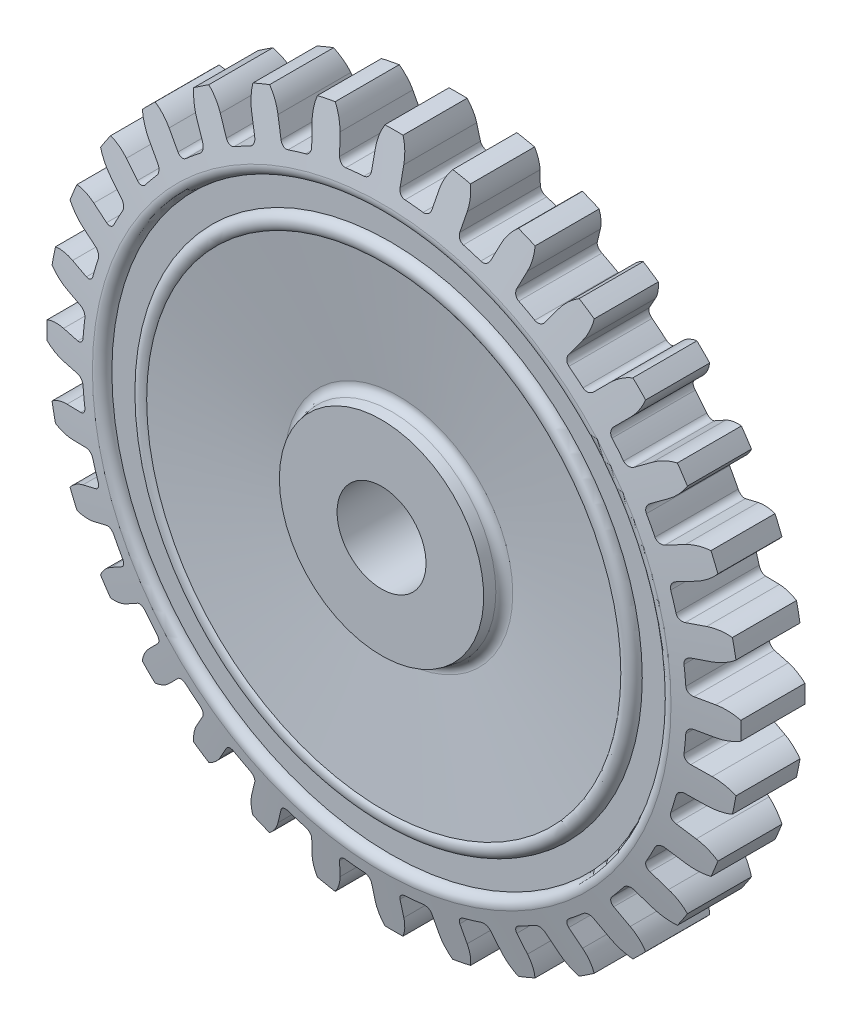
SolidWorks part; units mm, degrees
ref_plane "Спереди" through (0, 0, 0) normal (0, 0, 1) x (1, 0, 0)
ref_plane "Сверху" through (0, 0, 0) normal (0, 1, 0) x (1, 0, 0)
ref_plane "Справа" through (0, 0, 0) normal (1, 0, 0) x (0, 0, -1)
sketch "Эскиз1" plane through (0, 0, 0) normal (0, 1, 0) x (1, 0, 0)
  line L0 (-39, 0) -> (0, 0) construction
  line L1 (-39, -3.6) -> (-39, 3.6)
  line L2 (-5, 5) -> (-5, -5)
  line L3 (-5, 5) -> (-11.485, 5)
  line L4 (-39, 3.6) -> (-32.5163, 4.9781)
  line L5 (-31.3084, 4) -> (-28.3084, 4)
  line L6 (-11.485, 5) -> (-11.7107, 3.8603)
  line L7 (-12.8127, 3.0619) -> (-26.647, 4.75)
  line L8 (-5, -5) -> (-11.485, -5)
  line L9 (-11.485, -5) -> (-11.7107, -3.8603)
  line L10 (-12.8127, -3.0619) -> (-26.647, -4.75)
  line L11 (-31.3084, -4) -> (-28.3084, -4)
  line L12 (-39, -3.6) -> (-32.5163, -4.9781)
  line L13 (0, 5) -> (0, -5) construction
  arc A0 (-31.3084, 4) -> (-32.5163, 4.9781) centre (-32.3084, 4) ccw
  arc A1 (-26.647, 4.75) -> (-28.3084, 4) centre (-27.3084, 4) ccw
  arc A2 (-11.7107, 3.8603) -> (-12.8127, 3.0619) centre (-12.6916, 4.0546) cw
  arc A3 (-11.7107, -3.8603) -> (-12.8127, -3.0619) centre (-12.6916, -4.0546) ccw
  arc A4 (-26.647, -4.75) -> (-28.3084, -4) centre (-27.3084, -4) cw
  arc A5 (-31.3084, -4) -> (-32.5163, -4.9781) centre (-32.3084, -4) cw
  point P17 (-5, 0)
  dimension "D7" = 2
  dimension "D13" = 1
  dimension "D1" = 39
  dimension "D2" = 5
  dimension "D3" = 5
  dimension "D4" = 6.485
  dimension "D5" = 3.6
  dimension "D6" = 12
  dimension "D8" = 3
  dimension "D9" = 4
  dimension "D10" = 11.2
  dimension "D11" = 6.957
  dimension "D12" = 0.25
revolve "Повернуть1" add sketch "Эскиз1" angle 360 about L13
sketch "Эскиз6" plane through (0, 0, 0) normal (0, 0, 1) x (1, 0, 0)
  line L0 (0, 50.9999) -> (0, 0) construction
  line L1 (1.6, 36.6426) -> (1.6, 34.6301)
  line L2 (0, 0) -> (3.607, 36.6228) construction
  line L3 (-1.6, 36.6426) -> (-1.6, 34.6301)
  line L4 (8.7179, 35.6264) -> (8.3253, 33.6525)
  line L5 (5.5794, 36.2507) -> (5.1867, 34.2768)
  line L6 (15.5007, 33.2411) -> (14.7306, 31.3817)
  line L7 (12.5443, 34.4656) -> (11.7742, 32.6063)
  line L8 (21.6879, 29.5783) -> (20.5698, 27.905)
  line L9 (19.0272, 31.3561) -> (17.9091, 29.6828)
  line L10 (27.0416, 24.7789) -> (25.6185, 23.3558)
  line L11 (24.7789, 27.0416) -> (23.3558, 25.6185)
  line L12 (31.3561, 19.0272) -> (29.6828, 17.9091)
  line L13 (29.5783, 21.6879) -> (27.905, 20.5698)
  line L14 (34.4656, 12.5443) -> (32.6063, 11.7742)
  line L15 (33.2411, 15.5007) -> (31.3817, 14.7306)
  line L16 (36.2507, 5.5794) -> (34.2768, 5.1867)
  line L17 (35.6264, 8.7179) -> (33.6525, 8.3253)
  line L18 (36.6426, -1.6) -> (34.6301, -1.6)
  line L19 (36.6426, 1.6) -> (34.6301, 1.6)
  line L20 (35.6264, -8.7179) -> (33.6525, -8.3253)
  line L21 (36.2507, -5.5794) -> (34.2768, -5.1867)
  line L22 (33.2411, -15.5007) -> (31.3817, -14.7306)
  line L23 (34.4656, -12.5443) -> (32.6063, -11.7742)
  line L24 (29.5783, -21.6879) -> (27.905, -20.5698)
  line L25 (31.3561, -19.0272) -> (29.6828, -17.9091)
  line L26 (24.7789, -27.0416) -> (23.3558, -25.6185)
  line L27 (27.0416, -24.7789) -> (25.6185, -23.3558)
  line L28 (19.0272, -31.3561) -> (17.9091, -29.6828)
  line L29 (21.6879, -29.5783) -> (20.5698, -27.905)
  line L30 (12.5443, -34.4656) -> (11.7742, -32.6063)
  line L31 (15.5007, -33.2411) -> (14.7306, -31.3817)
  line L32 (5.5794, -36.2507) -> (5.1867, -34.2768)
  line L33 (8.7179, -35.6264) -> (8.3253, -33.6525)
  line L34 (-1.6, -36.6426) -> (-1.6, -34.6301)
  line L35 (1.6, -36.6426) -> (1.6, -34.6301)
  line L36 (-8.7179, -35.6264) -> (-8.3253, -33.6525)
  line L37 (-5.5794, -36.2507) -> (-5.1867, -34.2768)
  line L38 (-15.5007, -33.2411) -> (-14.7306, -31.3817)
  line L39 (-12.5443, -34.4656) -> (-11.7742, -32.6063)
  line L40 (-21.6879, -29.5783) -> (-20.5698, -27.905)
  line L41 (-19.0272, -31.3561) -> (-17.9091, -29.6828)
  line L42 (-27.0416, -24.7789) -> (-25.6185, -23.3558)
  line L43 (-24.7789, -27.0416) -> (-23.3558, -25.6185)
  line L44 (-31.3561, -19.0272) -> (-29.6828, -17.9091)
  line L45 (-29.5783, -21.6879) -> (-27.905, -20.5698)
  line L46 (-34.4656, -12.5443) -> (-32.6063, -11.7742)
  line L47 (-33.2411, -15.5007) -> (-31.3817, -14.7306)
  line L48 (-36.2507, -5.5794) -> (-34.2768, -5.1867)
  line L49 (-35.6264, -8.7179) -> (-33.6525, -8.3253)
  line L50 (-36.6426, 1.6) -> (-34.6301, 1.6)
  line L51 (-36.6426, -1.6) -> (-34.6301, -1.6)
  line L52 (-35.6264, 8.7179) -> (-33.6525, 8.3253)
  line L53 (-36.2507, 5.5794) -> (-34.2768, 5.1867)
  line L54 (-33.2411, 15.5007) -> (-31.3817, 14.7306)
  line L55 (-34.4656, 12.5443) -> (-32.6063, 11.7742)
  line L56 (-29.5783, 21.6879) -> (-27.905, 20.5698)
  line L57 (-31.3561, 19.0272) -> (-29.6828, 17.9091)
  line L58 (-24.7789, 27.0416) -> (-23.3558, 25.6185)
  line L59 (-27.0416, 24.7789) -> (-25.6185, 23.3558)
  line L60 (-19.0272, 31.3561) -> (-17.9091, 29.6828)
  line L61 (-21.6879, 29.5783) -> (-20.5698, 27.905)
  line L62 (-12.5443, 34.4656) -> (-11.7742, 32.6063)
  line L63 (-15.5007, 33.2411) -> (-14.7306, 31.3817)
  line L64 (-5.5794, 36.2507) -> (-5.1867, 34.2768)
  line L65 (-8.7179, 35.6264) -> (-8.3253, 33.6525)
  arc A0 (-2.3087, 33.8714) -> (-4.3436, 33.671) centre (0, 0) ccw
  circle A1 centre (0, 0) radius 36.8 construction
  circle A2 centre (0, 0) radius 39 construction
  arc A3 (1.0164, 38.9868) -> (-1.0164, 38.9868) centre (0, 0) ccw
  arc A4 (-1.0164, 38.9868) -> (-1.6, 36.6426) centre (3.4, 36.6426) ccw
  arc A5 (1.0164, 38.9868) -> (1.6, 36.6426) centre (-3.4, 36.6426) cw
  arc A6 (8.6028, 38.0393) -> (6.609, 38.4359) centre (0, 0) ccw
  arc A7 (6.609, 38.4359) -> (5.5794, 36.2507) centre (10.4833, 35.2752) ccw
  arc A8 (8.6028, 38.0393) -> (8.7179, 35.6264) centre (3.8139, 36.6018) cw
  arc A9 (15.8587, 35.6301) -> (13.9805, 36.408) centre (0, 0) ccw
  arc A10 (13.9805, 36.408) -> (12.5443, 34.4656) centre (17.1637, 32.5522) ccw
  arc A11 (15.8587, 35.6301) -> (15.5007, 33.2411) centre (10.8813, 35.1545) cw
  arc A12 (22.505, 31.8516) -> (20.8147, 32.981) centre (0, 0) ccw
  arc A13 (20.8147, 32.981) -> (19.0272, 31.3561) centre (23.1845, 28.5783) ccw
  arc A14 (22.505, 31.8516) -> (21.6879, 29.5783) centre (17.5305, 32.3561) cw
  arc A15 (28.2865, 26.8491) -> (26.8491, 28.2865) centre (0, 0) ccw
  arc A16 (26.8491, 28.2865) -> (24.7789, 27.0416) centre (28.3144, 23.5061) ccw
  arc A17 (28.2865, 26.8491) -> (27.0416, 24.7789) centre (23.5061, 28.3144) cw
  arc A18 (32.981, 20.8147) -> (31.8516, 22.505) centre (0, 0) ccw
  arc A19 (31.8516, 22.505) -> (29.5783, 21.6879) centre (32.3561, 17.5305) ccw
  arc A20 (32.981, 20.8147) -> (31.3561, 19.0272) centre (28.5783, 23.1845) cw
  arc A21 (36.408, 13.9805) -> (35.6301, 15.8587) centre (0, 0) ccw
  arc A22 (35.6301, 15.8587) -> (33.2411, 15.5007) centre (35.1545, 10.8813) ccw
  arc A23 (36.408, 13.9805) -> (34.4656, 12.5443) centre (32.5522, 17.1637) cw
  arc A24 (38.4359, 6.609) -> (38.0393, 8.6028) centre (0, 0) ccw
  arc A25 (38.0393, 8.6028) -> (35.6264, 8.7179) centre (36.6018, 3.8139) ccw
  arc A26 (38.4359, 6.609) -> (36.2507, 5.5794) centre (35.2752, 10.4833) cw
  arc A27 (38.9868, -1.0164) -> (38.9868, 1.0164) centre (0, 0) ccw
  arc A28 (38.9868, 1.0164) -> (36.6426, 1.6) centre (36.6426, -3.4) ccw
  arc A29 (38.9868, -1.0164) -> (36.6426, -1.6) centre (36.6426, 3.4) cw
  arc A30 (38.0393, -8.6028) -> (38.4359, -6.609) centre (0, 0) ccw
  arc A31 (38.4359, -6.609) -> (36.2507, -5.5794) centre (35.2752, -10.4833) ccw
  arc A32 (38.0393, -8.6028) -> (35.6264, -8.7179) centre (36.6018, -3.8139) cw
  arc A33 (35.6301, -15.8587) -> (36.408, -13.9805) centre (0, 0) ccw
  arc A34 (36.408, -13.9805) -> (34.4656, -12.5443) centre (32.5522, -17.1637) ccw
  arc A35 (35.6301, -15.8587) -> (33.2411, -15.5007) centre (35.1545, -10.8813) cw
  arc A36 (31.8516, -22.505) -> (32.981, -20.8147) centre (0, 0) ccw
  arc A37 (32.981, -20.8147) -> (31.3561, -19.0272) centre (28.5783, -23.1845) ccw
  arc A38 (31.8516, -22.505) -> (29.5783, -21.6879) centre (32.3561, -17.5305) cw
  arc A39 (26.8491, -28.2865) -> (28.2865, -26.8491) centre (0, 0) ccw
  arc A40 (28.2865, -26.8491) -> (27.0416, -24.7789) centre (23.5061, -28.3144) ccw
  arc A41 (26.8491, -28.2865) -> (24.7789, -27.0416) centre (28.3144, -23.5061) cw
  arc A42 (20.8147, -32.981) -> (22.505, -31.8516) centre (0, 0) ccw
  arc A43 (22.505, -31.8516) -> (21.6879, -29.5783) centre (17.5305, -32.3561) ccw
  arc A44 (20.8147, -32.981) -> (19.0272, -31.3561) centre (23.1845, -28.5783) cw
  arc A45 (13.9805, -36.408) -> (15.8587, -35.6301) centre (0, 0) ccw
  arc A46 (15.8587, -35.6301) -> (15.5007, -33.2411) centre (10.8813, -35.1545) ccw
  arc A47 (13.9805, -36.408) -> (12.5443, -34.4656) centre (17.1637, -32.5522) cw
  arc A48 (6.609, -38.4359) -> (8.6028, -38.0393) centre (0, 0) ccw
  arc A49 (8.6028, -38.0393) -> (8.7179, -35.6264) centre (3.8139, -36.6018) ccw
  arc A50 (6.609, -38.4359) -> (5.5794, -36.2507) centre (10.4833, -35.2752) cw
  arc A51 (-1.0164, -38.9868) -> (1.0164, -38.9868) centre (0, 0) ccw
  arc A52 (1.0164, -38.9868) -> (1.6, -36.6426) centre (-3.4, -36.6426) ccw
  arc A53 (-1.0164, -38.9868) -> (-1.6, -36.6426) centre (3.4, -36.6426) cw
  arc A54 (-8.6028, -38.0393) -> (-6.609, -38.4359) centre (0, 0) ccw
  arc A55 (-6.609, -38.4359) -> (-5.5794, -36.2507) centre (-10.4833, -35.2752) ccw
  arc A56 (-8.6028, -38.0393) -> (-8.7179, -35.6264) centre (-3.8139, -36.6018) cw
  arc A57 (-15.8587, -35.6301) -> (-13.9805, -36.408) centre (0, 0) ccw
  arc A58 (-13.9805, -36.408) -> (-12.5443, -34.4656) centre (-17.1637, -32.5522) ccw
  arc A59 (-15.8587, -35.6301) -> (-15.5007, -33.2411) centre (-10.8813, -35.1545) cw
  arc A60 (-22.505, -31.8516) -> (-20.8147, -32.981) centre (0, 0) ccw
  arc A61 (-20.8147, -32.981) -> (-19.0272, -31.3561) centre (-23.1845, -28.5783) ccw
  arc A62 (-22.505, -31.8516) -> (-21.6879, -29.5783) centre (-17.5305, -32.3561) cw
  arc A63 (-28.2865, -26.8491) -> (-26.8491, -28.2865) centre (0, 0) ccw
  arc A64 (-26.8491, -28.2865) -> (-24.7789, -27.0416) centre (-28.3144, -23.5061) ccw
  arc A65 (-28.2865, -26.8491) -> (-27.0416, -24.7789) centre (-23.5061, -28.3144) cw
  arc A66 (-32.981, -20.8147) -> (-31.8516, -22.505) centre (0, 0) ccw
  arc A67 (-31.8516, -22.505) -> (-29.5783, -21.6879) centre (-32.3561, -17.5305) ccw
  arc A68 (-32.981, -20.8147) -> (-31.3561, -19.0272) centre (-28.5783, -23.1845) cw
  arc A69 (-36.408, -13.9805) -> (-35.6301, -15.8587) centre (0, 0) ccw
  arc A70 (-35.6301, -15.8587) -> (-33.2411, -15.5007) centre (-35.1545, -10.8813) ccw
  arc A71 (-36.408, -13.9805) -> (-34.4656, -12.5443) centre (-32.5522, -17.1637) cw
  arc A72 (-38.4359, -6.609) -> (-38.0393, -8.6028) centre (0, 0) ccw
  arc A73 (-38.0393, -8.6028) -> (-35.6264, -8.7179) centre (-36.6018, -3.8139) ccw
  arc A74 (-38.4359, -6.609) -> (-36.2507, -5.5794) centre (-35.2752, -10.4833) cw
  arc A75 (-38.9868, 1.0164) -> (-38.9868, -1.0164) centre (0, 0) ccw
  arc A76 (-38.9868, -1.0164) -> (-36.6426, -1.6) centre (-36.6426, 3.4) ccw
  arc A77 (-38.9868, 1.0164) -> (-36.6426, 1.6) centre (-36.6426, -3.4) cw
  arc A78 (-38.0393, 8.6028) -> (-38.4359, 6.609) centre (0, 0) ccw
  arc A79 (-38.4359, 6.609) -> (-36.2507, 5.5794) centre (-35.2752, 10.4833) ccw
  arc A80 (-38.0393, 8.6028) -> (-35.6264, 8.7179) centre (-36.6018, 3.8139) cw
  arc A81 (-35.6301, 15.8587) -> (-36.408, 13.9805) centre (0, 0) ccw
  arc A82 (-36.408, 13.9805) -> (-34.4656, 12.5443) centre (-32.5522, 17.1637) ccw
  arc A83 (-35.6301, 15.8587) -> (-33.2411, 15.5007) centre (-35.1545, 10.8813) cw
  arc A84 (-31.8516, 22.505) -> (-32.981, 20.8147) centre (0, 0) ccw
  arc A85 (-32.981, 20.8147) -> (-31.3561, 19.0272) centre (-28.5783, 23.1845) ccw
  arc A86 (-31.8516, 22.505) -> (-29.5783, 21.6879) centre (-32.3561, 17.5305) cw
  arc A87 (-26.8491, 28.2865) -> (-28.2865, 26.8491) centre (0, 0) ccw
  arc A88 (-28.2865, 26.8491) -> (-27.0416, 24.7789) centre (-23.5061, 28.3144) ccw
  arc A89 (-26.8491, 28.2865) -> (-24.7789, 27.0416) centre (-28.3144, 23.5061) cw
  arc A90 (-20.8147, 32.981) -> (-22.505, 31.8516) centre (0, 0) ccw
  arc A91 (-22.505, 31.8516) -> (-21.6879, 29.5783) centre (-17.5305, 32.3561) ccw
  arc A92 (-20.8147, 32.981) -> (-19.0272, 31.3561) centre (-23.1845, 28.5783) cw
  arc A93 (-13.9805, 36.408) -> (-15.8587, 35.6301) centre (0, 0) ccw
  arc A94 (-15.8587, 35.6301) -> (-15.5007, 33.2411) centre (-10.8813, 35.1545) ccw
  arc A95 (-13.9805, 36.408) -> (-12.5443, 34.4656) centre (-17.1637, 32.5522) cw
  arc A96 (-6.609, 38.4359) -> (-8.6028, 38.0393) centre (0, 0) ccw
  arc A97 (-8.6028, 38.0393) -> (-8.7179, 35.6264) centre (-3.8139, 36.6018) ccw
  arc A98 (-6.609, 38.4359) -> (-5.5794, 36.2507) centre (-10.4833, 35.2752) cw
  arc A99 (4.3436, 33.671) -> (2.3087, 33.8714) centre (0, 0) ccw
  arc A100 (10.829, 32.1766) -> (8.8723, 32.7702) centre (0, 0) ccw
  arc A101 (-8.8723, 32.7702) -> (-10.829, 32.1766) centre (0, 0) ccw
  arc A102 (-15.095, 30.4096) -> (-16.8983, 29.4457) centre (0, 0) ccw
  arc A103 (-20.7376, 26.8804) -> (-22.3182, 25.5832) centre (0, 0) ccw
  arc A104 (-25.5832, 22.3182) -> (-26.8804, 20.7376) centre (0, 0) ccw
  arc A105 (-29.4457, 16.8983) -> (-30.4096, 15.095) centre (0, 0) ccw
  arc A106 (-32.1766, 10.829) -> (-32.7702, 8.8723) centre (0, 0) ccw
  arc A107 (-33.671, 4.3436) -> (-33.8714, 2.3087) centre (0, 0) ccw
  arc A108 (-33.8714, -2.3087) -> (-33.671, -4.3436) centre (0, 0) ccw
  arc A109 (-32.7702, -8.8723) -> (-32.1766, -10.829) centre (0, 0) ccw
  arc A110 (-30.4096, -15.095) -> (-29.4457, -16.8983) centre (0, 0) ccw
  arc A111 (-26.8804, -20.7376) -> (-25.5832, -22.3182) centre (0, 0) ccw
  arc A112 (-22.3182, -25.5832) -> (-20.7376, -26.8804) centre (0, 0) ccw
  arc A113 (-16.8983, -29.4457) -> (-15.095, -30.4096) centre (0, 0) ccw
  arc A114 (-10.829, -32.1766) -> (-8.8723, -32.7702) centre (0, 0) ccw
  arc A115 (-4.3436, -33.671) -> (-2.3087, -33.8714) centre (0, 0) ccw
  arc A116 (2.3087, -33.8714) -> (4.3436, -33.671) centre (0, 0) ccw
  arc A117 (8.8723, -32.7702) -> (10.829, -32.1766) centre (0, 0) ccw
  arc A118 (15.095, -30.4096) -> (16.8983, -29.4457) centre (0, 0) ccw
  arc A119 (20.7376, -26.8804) -> (22.3182, -25.5832) centre (0, 0) ccw
  arc A120 (25.5832, -22.3182) -> (26.8804, -20.7376) centre (0, 0) ccw
  arc A121 (29.4457, -16.8983) -> (30.4096, -15.095) centre (0, 0) ccw
  arc A122 (32.1766, -10.829) -> (32.7702, -8.8723) centre (0, 0) ccw
  arc A123 (33.671, -4.3436) -> (33.8714, -2.3087) centre (0, 0) ccw
  arc A124 (33.8714, 2.3087) -> (33.671, 4.3436) centre (0, 0) ccw
  arc A125 (32.7702, 8.8723) -> (32.1766, 10.829) centre (0, 0) ccw
  arc A126 (30.4096, 15.095) -> (29.4457, 16.8983) centre (0, 0) ccw
  arc A127 (26.8804, 20.7376) -> (25.5832, 22.3182) centre (0, 0) ccw
  arc A128 (22.3182, 25.5832) -> (20.7376, 26.8804) centre (0, 0) ccw
  arc A129 (16.8983, 29.4457) -> (15.095, 30.4096) centre (0, 0) ccw
  arc A130 (-29.6828, 17.9091) -> (-29.4457, 16.8983) centre (-30.1053, 17.2768) cw
  arc A131 (-31.3817, 14.7306) -> (-30.4096, 15.095) centre (-31.0907, 15.4331) ccw
  arc A132 (-25.6185, 23.3558) -> (-25.5832, 22.3182) centre (-26.1562, 22.8181) cw
  arc A133 (-27.905, 20.5698) -> (-26.8804, 20.7376) centre (-27.4825, 21.2021) ccw
  arc A134 (-32.6063, 11.7742) -> (-32.1766, 10.829) centre (-32.8973, 11.0716) cw
  arc A135 (-33.6525, 8.3253) -> (-32.7702, 8.8723) centre (-33.5042, 9.0711) ccw
  arc A136 (-34.6301, 1.6) -> (-33.8714, 2.3087) centre (-34.6301, 2.3604) ccw
  arc A137 (-34.2768, 5.1867) -> (-33.671, 4.3436) centre (-34.4252, 4.4409) cw
  arc A138 (-34.2768, -5.1867) -> (-33.671, -4.3436) centre (-34.4252, -4.4409) ccw
  arc A139 (-34.6301, -1.6) -> (-33.8714, -2.3087) centre (-34.6301, -2.3604) cw
  arc A140 (-33.6525, -8.3253) -> (-32.7702, -8.8723) centre (-33.5042, -9.0711) cw
  arc A141 (-32.6063, -11.7742) -> (-32.1766, -10.829) centre (-32.8973, -11.0716) ccw
  arc A142 (-31.3817, -14.7306) -> (-30.4096, -15.095) centre (-31.0907, -15.4331) cw
  arc A143 (-29.6828, -17.9091) -> (-29.4457, -16.8983) centre (-30.1053, -17.2768) ccw
  arc A144 (-27.905, -20.5698) -> (-26.8804, -20.7376) centre (-27.4825, -21.2021) cw
  arc A145 (-25.6185, -23.3558) -> (-25.5832, -22.3182) centre (-26.1562, -22.8181) ccw
  arc A146 (-23.3558, -25.6185) -> (-22.3182, -25.5832) centre (-22.8181, -26.1562) cw
  arc A147 (-20.5698, -27.905) -> (-20.7376, -26.8804) centre (-21.2021, -27.4825) ccw
  arc A148 (-17.9091, -29.6828) -> (-16.8983, -29.4457) centre (-17.2768, -30.1053) cw
  arc A149 (-14.7306, -31.3817) -> (-15.095, -30.4096) centre (-15.4331, -31.0907) ccw
  arc A150 (-8.3253, -33.6525) -> (-8.8723, -32.7702) centre (-9.0711, -33.5042) ccw
  arc A151 (-11.7742, -32.6063) -> (-10.829, -32.1766) centre (-11.0716, -32.8973) cw
  arc A152 (-5.1867, -34.2768) -> (-4.3436, -33.671) centre (-4.4409, -34.4252) cw
  arc A153 (-1.6, -34.6301) -> (-2.3087, -33.8714) centre (-2.3604, -34.6301) ccw
  arc A154 (1.6, -34.6301) -> (2.3087, -33.8714) centre (2.3604, -34.6301) cw
  arc A155 (5.1867, -34.2768) -> (4.3436, -33.671) centre (4.4409, -34.4252) ccw
  arc A156 (8.3253, -33.6525) -> (8.8723, -32.7702) centre (9.0711, -33.5042) cw
  arc A157 (17.9091, -29.6828) -> (16.8983, -29.4457) centre (17.2768, -30.1053) ccw
  arc A158 (14.7306, -31.3817) -> (15.095, -30.4096) centre (15.4331, -31.0907) cw
  arc A159 (11.7742, -32.6063) -> (10.829, -32.1766) centre (11.0716, -32.8973) ccw
  arc A160 (20.5698, -27.905) -> (20.7376, -26.8804) centre (21.2021, -27.4825) cw
  arc A161 (23.3558, -25.6185) -> (22.3182, -25.5832) centre (22.8181, -26.1562) ccw
  arc A162 (27.905, -20.5698) -> (26.8804, -20.7376) centre (27.4825, -21.2021) ccw
  arc A163 (25.6185, -23.3558) -> (25.5832, -22.3182) centre (26.1562, -22.8181) cw
  arc A164 (29.6828, -17.9091) -> (29.4457, -16.8983) centre (30.1053, -17.2768) cw
  arc A165 (31.3817, -14.7306) -> (30.4096, -15.095) centre (31.0907, -15.4331) ccw
  arc A166 (32.6063, -11.7742) -> (32.1766, -10.829) centre (32.8973, -11.0716) cw
  arc A167 (33.6525, -8.3253) -> (32.7702, -8.8723) centre (33.5042, -9.0711) ccw
  arc A168 (34.2768, -5.1867) -> (33.671, -4.3436) centre (34.4252, -4.4409) cw
  arc A169 (34.6301, -1.6) -> (33.8714, -2.3087) centre (34.6301, -2.3604) ccw
  arc A170 (34.6301, 1.6) -> (33.8714, 2.3087) centre (34.6301, 2.3604) cw
  arc A171 (34.2768, 5.1867) -> (33.671, 4.3436) centre (34.4252, 4.4409) ccw
  arc A172 (33.6525, 8.3253) -> (32.7702, 8.8723) centre (33.5042, 9.0711) cw
  arc A173 (32.6063, 11.7742) -> (32.1766, 10.829) centre (32.8973, 11.0716) ccw
  arc A174 (31.3817, 14.7306) -> (30.4096, 15.095) centre (31.0907, 15.4331) cw
  arc A175 (29.6828, 17.9091) -> (29.4457, 16.8983) centre (30.1053, 17.2768) ccw
  arc A176 (25.6185, 23.3558) -> (25.5832, 22.3182) centre (26.1562, 22.8181) ccw
  arc A177 (27.905, 20.5698) -> (26.8804, 20.7376) centre (27.4825, 21.2021) cw
  arc A178 (23.3558, 25.6185) -> (22.3182, 25.5832) centre (22.8181, 26.1562) cw
  arc A179 (20.5698, 27.905) -> (20.7376, 26.8804) centre (21.2021, 27.4825) ccw
  arc A180 (14.7306, 31.3817) -> (15.095, 30.4096) centre (15.4331, 31.0907) ccw
  arc A181 (17.9091, 29.6828) -> (16.8983, 29.4457) centre (17.2768, 30.1053) cw
  arc A182 (11.7742, 32.6063) -> (10.829, 32.1766) centre (11.0716, 32.8973) cw
  arc A183 (8.3253, 33.6525) -> (8.8723, 32.7702) centre (9.0711, 33.5042) ccw
  arc A184 (5.1867, 34.2768) -> (4.3436, 33.671) centre (4.4409, 34.4252) cw
  arc A185 (1.6, 34.6301) -> (2.3087, 33.8714) centre (2.3604, 34.6301) ccw
  arc A186 (-23.3558, 25.6185) -> (-22.3182, 25.5832) centre (-22.8181, 26.1562) ccw
  arc A187 (-20.5698, 27.905) -> (-20.7376, 26.8804) centre (-21.2021, 27.4825) cw
  arc A188 (-17.9091, 29.6828) -> (-16.8983, 29.4457) centre (-17.2768, 30.1053) ccw
  arc A189 (-14.7306, 31.3817) -> (-15.095, 30.4096) centre (-15.4331, 31.0907) cw
  arc A190 (-11.7742, 32.6063) -> (-10.829, 32.1766) centre (-11.0716, 32.8973) ccw
  arc A191 (-8.3253, 33.6525) -> (-8.8723, 32.7702) centre (-9.0711, 33.5042) cw
  arc A192 (-1.6, 34.6301) -> (-2.3087, 33.8714) centre (-2.3604, 34.6301) cw
  arc A193 (-5.1867, 34.2768) -> (-4.3436, 33.671) centre (-4.4409, 34.4252) ccw
  point P405 (1.6, 33.9123)
  point P420 (-1.6, 33.9123)
  dimension "D1" = 67.9
  dimension "D2" = 73.6
  dimension "D5" = 10
  dimension "D7" = 32
  dimension "D6" = 0.7604
  dimension "D3" = 1.6
  dimension "D4" = 5.625
extrude "Вырез-Вытянуть3" cut sketch "Эскиз6" against normal mid plane 10 flip side to cut
